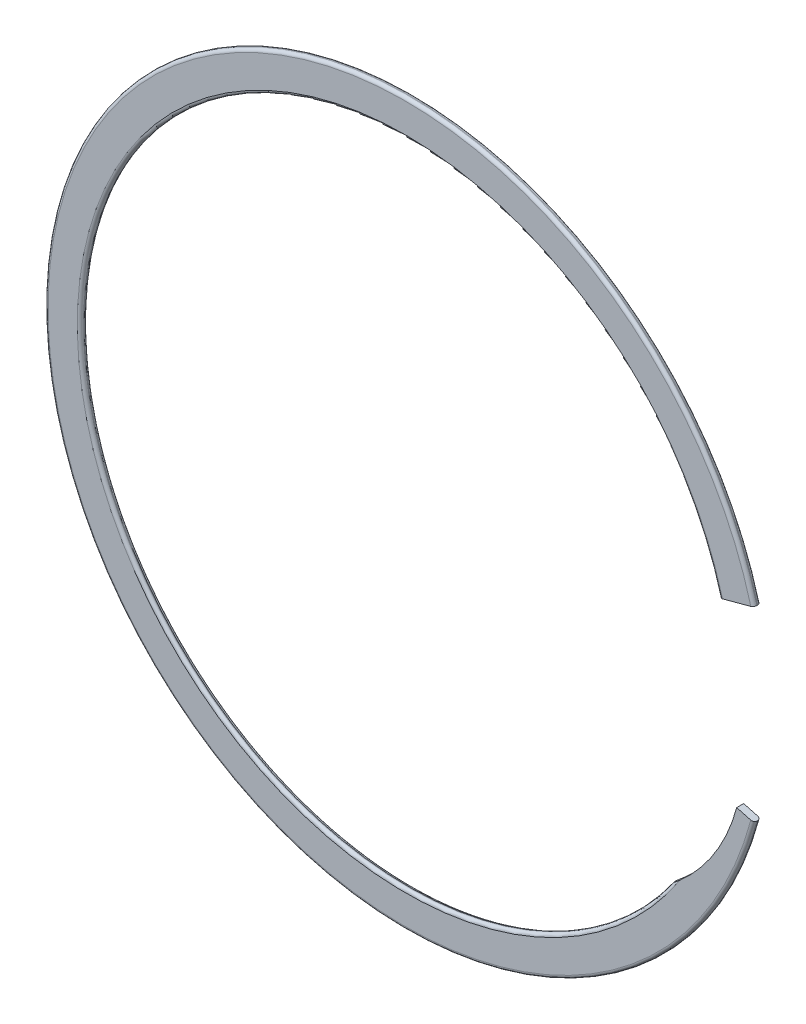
SolidWorks part; units mm, degrees
ref_plane "Front Plane" through (0, 0, 0) normal (0, 0, 1) x (1, 0, 0)
ref_plane "Top Plane" through (0, 0, 0) normal (0, 1, 0) x (1, 0, 0)
ref_plane "Right Plane" through (0, 0, 0) normal (1, 0, 0) x (0, 0, -1)
sketch "Sketch1" plane through (0, 0, 0) normal (0, 0, 1) x (1, 0, 0)
  line L0 (36.7284, 0) -> (40.7416, 0) construction
  line L1 (-36.7284, 0) -> (-40.7416, 0) construction
  line L2 (35.4769, 9.506) -> (39.3534, 10.5447)
  line L3 (35.4769, -9.506) -> (39.3534, -10.5447)
  line L4 (37.4151, -10.0254) -> (34.1467, -22.2235) construction
  line L5 (34.1467, -22.2235) -> (30.0454, -21.1246) construction
  circle A0 centre (0, 0) radius 36.7284
  circle A1 centre (0, 0) radius 40.7416
  arc A2 (37.4151, -10.0254) -> (30.0454, -21.1246) centre (17.2243, -4.6152) cw
  dimension "Free Diameter" = 73.4568
  dimension "Radial Wall" = 4.0132
  dimension "D3" = 30
sketch "Sketch2" plane through (0, 0, 0) normal (0, 0, 1) x (1, 0, 0)
  line L0 (35.4769, -9.506) -> (39.3534, -10.5447) construction
  line L1 (35.4769, 9.506) -> (39.3534, 10.5447) construction
  line L2 (37.4151, -10.0254) -> (39.3534, -10.5447)
  line L3 (35.4769, 9.506) -> (39.3534, 10.5447)
  circle A0 centre (0, 0) radius 40.7416 construction
  arc A1 (30.0454, -21.1246) -> (37.4151, -10.0254) centre (17.2243, -4.6152) ccw construction
  circle A2 centre (0, 0) radius 36.7284 construction
  arc A3 (39.3534, 10.5447) -> (39.3534, -10.5447) centre (0, 0) ccw
  arc A4 (30.0454, -21.1246) -> (37.4151, -10.0254) centre (17.2243, -4.6152) ccw
  arc A5 (35.4769, 9.506) -> (30.0454, -21.1246) centre (0, 0) ccw
  arc A6 (35.4769, 9.506) -> (30.0454, -21.1246) centre (0, 0) cw construction
  arc A7 (39.3534, 10.5447) -> (39.3534, -10.5447) centre (0, 0) cw construction
extrude "Extrude1" add sketch "Sketch2" along normal mid plane 0.7874
fillet "Fillet1" radius 0.3543 4 edges at (-40.7416, 0, -0.3937) (-40.7416, 0, 0.3937) (-36.1642, 6.4127, -0.3937) (-36.1642, 6.4127, 0.3937)
sketch "Sketch3" plane through (0, 0, 0) normal (1, 0, 0) x (0, 0, -1)
  line L0 (-0.4953, 38.1) -> (-0.4953, 37.1348)
  line L1 (-0.4953, 37.1348) -> (0.4953, 37.1348)
  line L2 (0.4953, 37.1348) -> (0.4953, 38.1)
  line L3 (0.4953, 38.1) -> (100.0125, 38.1)
  line L4 (100.0125, 38.1) -> (100.0125, 0)
  line L5 (-0.4953, 38.1) -> (-8.5725, 38.1)
  line L6 (-8.5725, 38.1) -> (-14.2875, 32.385)
  line L7 (-14.2875, 32.385) -> (-14.2875, 0)
  line L8 (-14.2875, 0) -> (100.0125, 0)
  line L9 (-14.2875, 0) -> (100.0125, 0) construction
  line L10 (0, 0) -> (0, 37.1348) construction
  dimension "D1" = 45
  dimension "Groove width" = 0.9906
  dimension "groove dia" = 74.2696
  dimension "shaft dia" = 76.2
  dimension "D2" = 64.77
  dimension "D3" = 114.3
  dimension "D4" = 14.2875
revolve "Revolve1" [suppressed] add sketch "Sketch3" angle 360 about L8
equation "\"D1@Fillet1\" = (\"Ring Thickness@Extrude1\"*.9)/2"
equation "\"D2@Sketch3\" = \"shaft dia@Sketch3\"*.85"
equation "\"D4@Sketch3\" = \"D3@Sketch3\"/8"
equation "\"D3@Sketch3\" = \"shaft dia@Sketch3\"*1.50"
